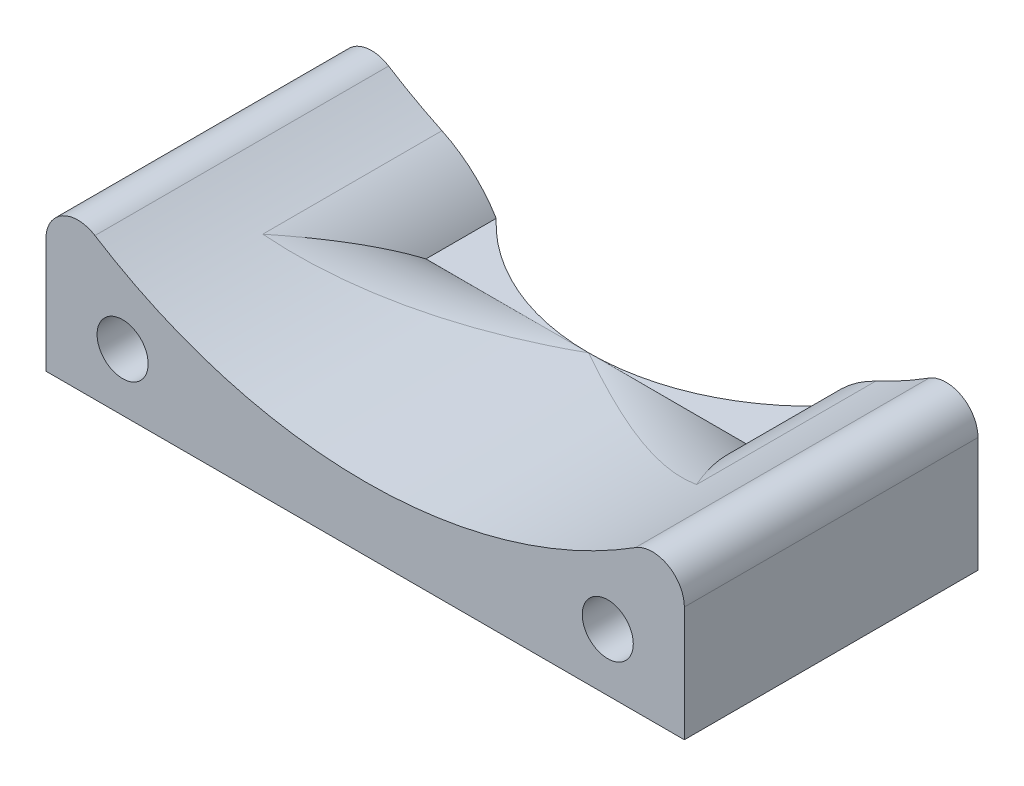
SolidWorks part; units mm, degrees
ref_plane "Front Plane" through (0, 0, 0) normal (0, 0, 1) x (1, 0, 0)
ref_plane "Top Plane" through (0, 0, 0) normal (0, 1, 0) x (1, 0, 0)
ref_plane "Right Plane" through (0, 0, 0) normal (1, 0, 0) x (0, 0, -1)
sketch "Sketch1" plane through (0, 0, 0) normal (0, 1, 0) x (1, 0, 0)
  circle A0 centre (0, 0) radius 35
  dimension "D1" = 70
extrude "Boss-Extrude1" add sketch "Sketch1" along normal blind 2
sketch "Sketch2" plane through (0, 2, 0) normal (0, 1, 0) x (1, 0, 0)
  circle A0 centre (-17.75, 17.75) radius 3.25
  circle A1 centre (17.75, 17.75) radius 3.25
  circle A2 centre (17.75, -17.75) radius 3.25
  circle A3 centre (-17.75, -17.75) radius 3.25
  dimension "D1" = 6.5
  dimension "D2" = 35.5
  dimension "D3" = 17.75
  dimension "D4" = 35.5
  dimension "D5" = 17.75
  dimension "D6" = 35.5
  dimension "D7" = 17.75
  dimension "D8" = 35.5
  dimension "D9" = 17.75
sketch "Sketch4" plane through (0, 2, 0) normal (0, 1, 0) x (1, 0, 0)
  line L0 (-25.4755, -24) -> (25.4755, -24)
  arc A0 (-25.4755, -24) -> (25.4755, -24) centre (0, 0) ccw
  dimension "D1" = 24
extrude "Cut-Extrude3" cut sketch "Sketch4" against normal blind 10
extrude "Cut-Extrude4" cut sketch "Sketch2" against normal through all
sketch "Sketch5" plane through (0, 0, 24) normal (0, 0, 1) x (1, 0, 0)
  line L0 (-50, 0) -> (50, 0)
  line L1 (50, 0) -> (50, 24)
  line L2 (50, 24) -> (-50, 24)
  line L3 (-50, 24) -> (-50, 0)
  dimension "D1" = 24
  dimension "D2" = 100
  dimension "D3" = 50
extrude "Boss-Extrude2" add sketch "Sketch5" along normal blind 120
sketch "Sketch7" plane through (0, 0, 144) normal (0, 0, 1) x (1, 0, 0)
  line L0 (50, 24) -> (-50, 24) construction
  line L1 (-50, 0) -> (50, 0) construction
  arc A0 (-45, 24) -> (45, 24) centre (0, 89.3214) ccw
  point P3 (0, 10)
  dimension "D3" = 10
  dimension "D1" = 90
  dimension "D2" = 45
extrude "Cut-Extrude6" cut sketch "Sketch7" against normal through all and the other way through all
sketch "Sketch9" plane through (0, 24, 0) normal (0, 1, 0) x (1, 0, 0)
  line L0 (-25.4755, -24) -> (25.4755, -24)
  arc A0 (-25.4755, -24) -> (25.4755, -24) centre (0, 0) ccw
extrude "Cut-Extrude7" cut sketch "Sketch9" against normal blind 22
sketch "Sketch11" plane through (0, 24, 0) normal (0, 1, 0) x (1, 0, 0)
  line L0 (0, -35) -> (-25.4755, -35)
  line L2 (-25.4755, -24) -> (-25.4755, -35)
  line L3 (-25.4755, -24) -> (25.4755, -24)
  line L4 (25.4755, -24) -> (25.4755, -35)
  line L6 (25.4755, -35) -> (0, -35)
  arc A0 (-25.4755, -24) -> (25.4755, -24) centre (0, 0) ccw construction
extrude "Cut-Extrude9" cut sketch "Sketch11" against normal blind 14
fillet "Fillet4" radius 20 4 edges at (25.4755, 14.2023, 29.5) (12.9099, 11.0576, 35) (-25.4755, 14.2023, 29.5) (-12.9099, 11.0576, 35)
fillet "Fillet6" radius 20 1 edges at (0, 10, 144)
fillet "Fillet7" radius 5 4 edges at (50, 1.7517, 144) (-50, 1.7517, 144) (50, 18.095, 139.7727) (-50, 13.5033, 142.1035)
ref_plane "Plane1" through (0, 0, 100) normal (0, 0, 1) x (1, 0, 0)
ref_plane "Plane2" through (0, 0, 70) normal (0, 0, 1) x (1, 0, 0)
ref_plane "Plane3" through (0, 0, 24) normal (0, 0, -1) x (-1, 0, 0)
sketch "Sketch12" plane through (0, 0, 70) normal (0, 0, 1) x (1, 0, 0)
  line L1 (-63.7091, 32.5619) -> (67.0207, 32.5619)
  line L2 (-63.7091, 32.5619) -> (-63.7091, -4.6543)
  line L3 (-63.7091, -4.6543) -> (67.0207, -4.6543)
  line L4 (67.0207, 32.5619) -> (67.0207, -4.6543)
extrude "Cut-Extrude11" cut sketch "Sketch12" along normal through all
sketch "Sketch13" plane through (0, 2, 0) normal (0, 1, 0) x (1, 0, 0)
  circle A0 centre (0, 0) radius 35
extrude "Cut-Extrude12" cut sketch "Sketch13" against normal blind 10
sketch "Sketch14" plane through (0, 0, 24) normal (0, 0, -1) x (-1, 0, 0)
  line L0 (50, 0) -> (-50, 0) construction
  line L1 (-15.25, 0) -> (15.25, 0)
  line L2 (-15.25, 0) -> (-15.25, 5.5)
  line L3 (-15.25, 5.5) -> (15.25, 5.5)
  line L4 (15.25, 0) -> (15.25, 5.5)
  dimension "D1" = 5.5
  dimension "D2" = 30.5
  dimension "D3" = 15.25
extrude "Cut-Extrude13" cut sketch "Sketch14" against normal blind 20
sketch "Sketch15" plane through (0, 0, 70) normal (0, 0, 1) x (1, 0, 0)
  line L1 (-50, 0) -> (50, 0) construction
  circle A0 centre (-38, 9) radius 4
  circle A1 centre (38, 9) radius 4
  dimension "D2" = 8
  dimension "D4" = 8
  dimension "D1" = 9
  dimension "D3" = 38
  dimension "D5" = 38
extrude "Cut-Extrude14" cut sketch "Sketch15" against normal blind 6
